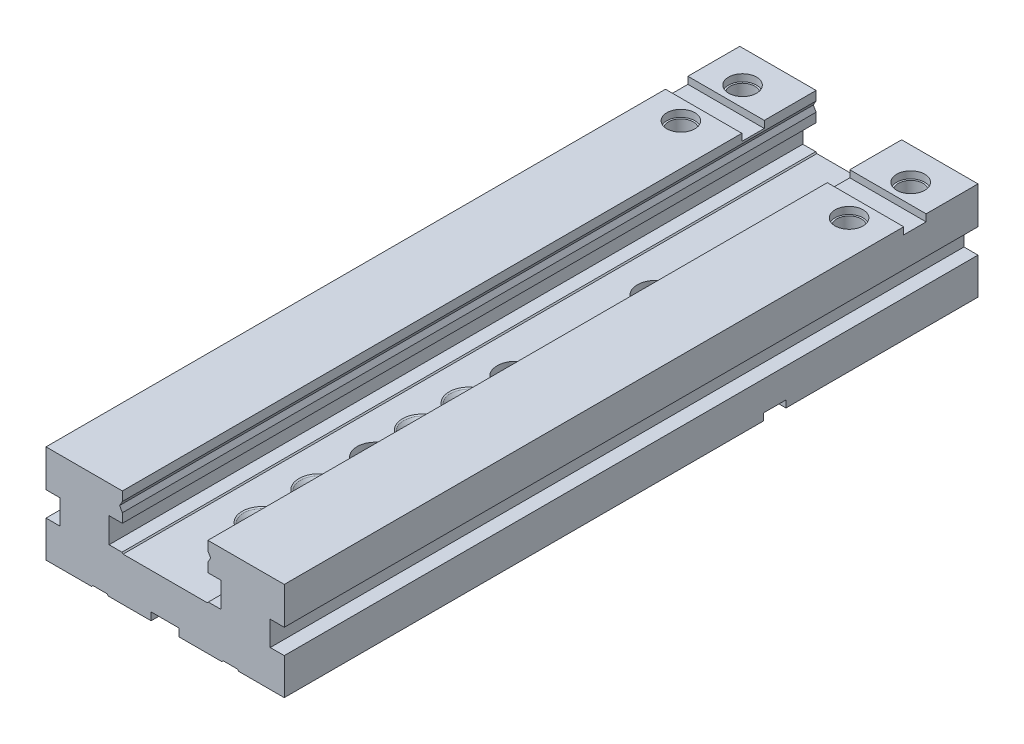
SolidWorks part; units mm, degrees
ref_plane "Front Plane" through (0, 0, 0) normal (0, 0, 1) x (1, 0, 0)
ref_plane "Top Plane" through (0, 0, 0) normal (0, 1, 0) x (1, 0, 0)
ref_plane "Right Plane" through (0, 0, 0) normal (1, 0, 0) x (0, 0, -1)
imported_body "Imported1"
sketch "Sketch1" plane through (0, -3.8, 0) normal (0, 1, 0) x (1, 0, 0)
  circle A0 centre (0, 150) radius 13
  circle A1 centre (0, 250) radius 13
  circle A2 centre (0, 350) radius 13
extrude "Boss-Extrude1" add sketch "Sketch1" against normal up to surface (25.7 mm away)
hole_wizard "Hole1" positions "Sketch3" profile "Sketch2" legacy
sketch "Sketch3" plane through (0, -3.8, 0) normal (0, 1, 0) x (1, 0, 0)
  line L0 (-30, 495) -> (30, 495) construction
  point P0 (0, 350)
  point P5 (0, 150)
  dimension "D1" = 145
  dimension "D2" = 200
sketch "Sketch2" plane through (0, -3.8, -350) normal (1, 0, 0) x (0, 0, 1)
  line L0 (0, 0) -> (0, 100)
  line L1 (0, 100) -> (8, 100)
  line L2 (8, 100) -> (8, 11)
  line L3 (8, 11) -> (13, 11)
  line L4 (13, 11) -> (13, 0)
  line L5 (13, 0) -> (0, 0)
  line L6 (0, 110) -> (0, -10) construction
  dimension "Diameter" = 16
  dimension "Depth" = 100
  dimension "C-Bore Diameter" = 26
  dimension "C-Bore Depth" = 11
hole_wizard "Hole2" positions "Sketch5" profile "Sketch4" legacy
sketch "Sketch5" plane through (0, -3.8, 0) normal (0, 1, 0) x (1, 0, 0)
  circle A0 centre (0, 350) radius 13 construction
  point P0 (0, 250)
  dimension "D1" = 100
sketch "Sketch4" plane through (0, -3.8, -250) normal (1, 0, 0) x (0, 0, 1)
  line L0 (0, 0) -> (0, 100)
  line L1 (0, 100) -> (8.5, 100)
  line L2 (8.5, 100) -> (8.5, 17)
  line L3 (8.5, 17) -> (13, 17)
  line L4 (13, 17) -> (13, 0)
  line L5 (13, 0) -> (0, 0)
  line L6 (0, 110) -> (0, -10) construction
  dimension "Diameter" = 17
  dimension "Depth" = 100
  dimension "C-Bore Diameter" = 26
  dimension "C-Bore Depth" = 17
